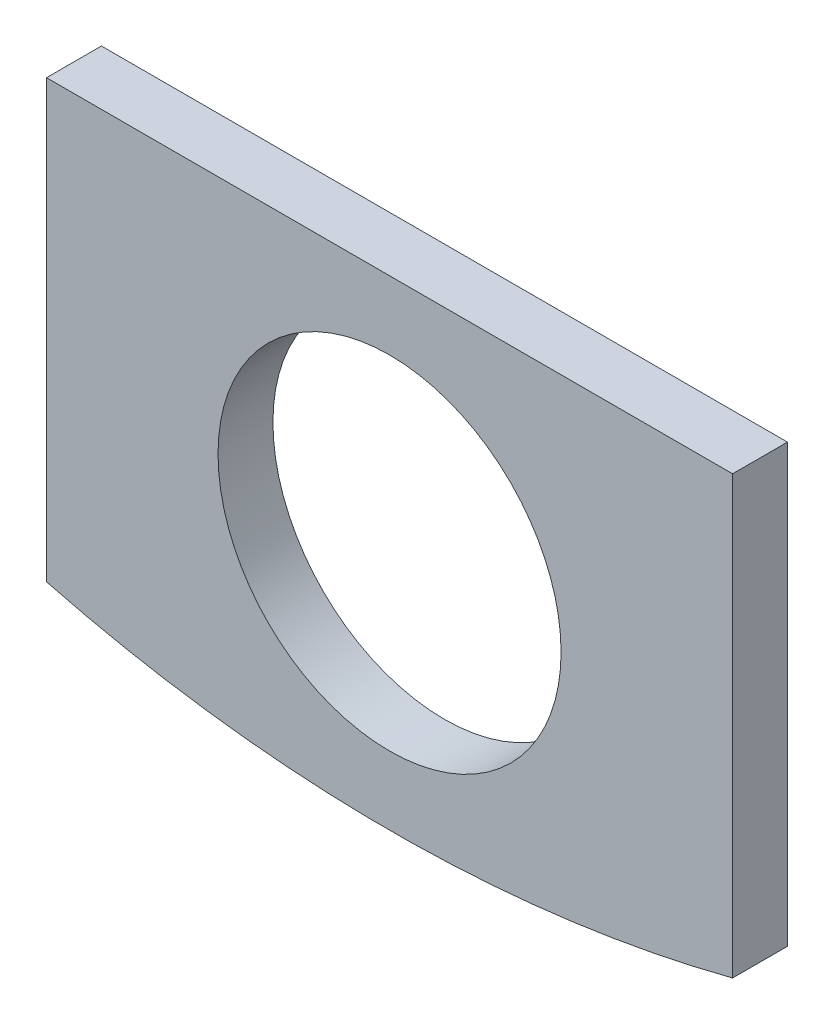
SolidWorks part; units mm, degrees
ref_plane "Front" through (0, 0, 0) normal (0, 0, 1) x (1, 0, 0)
ref_plane "Top" through (0, 0, 0) normal (0, 1, 0) x (1, 0, 0)
ref_plane "Right" through (0, 0, 0) normal (1, 0, 0) x (0, 0, -1)
sketch "Sketch1" plane through (0, 0, 0) normal (0, 0, 1) x (1, 0, 0)
  line L0 (0, 677.5056) -> (0, 791.8091) construction
  line L1 (-25, 3.1754) -> (-25, 35)
  line L2 (-25, 35) -> (25, 35)
  line L3 (0, -13.9368) -> (0, 43.4583) construction
  line L4 (25, 3.1754) -> (25, 35)
  line L5 (-83.1792, 0) -> (106.3024, 0) construction
  arc A0 (-25, 3.1754) -> (25, 3.1754) centre (0, 100) ccw
  dimension "D3" = 100
  dimension "D1" = 50
  dimension "D2" = 35
extrude "Base-Extrude" add sketch "Sketch1" along normal blind 4
sketch "Sketch3" plane through (0, 0, 4) normal (0, 0, 1) x (1, 0, 0)
  line L0 (0, 41.8279) -> (0, -17.6644) construction
  line L1 (25, 35) -> (-25, 35) construction
  circle A0 centre (0, 17.5) radius 12.5
  dimension "D1" = 25
  dimension "D2" = 17.5
extrude "Cut-Extrude1" cut sketch "Sketch3" against normal through all
